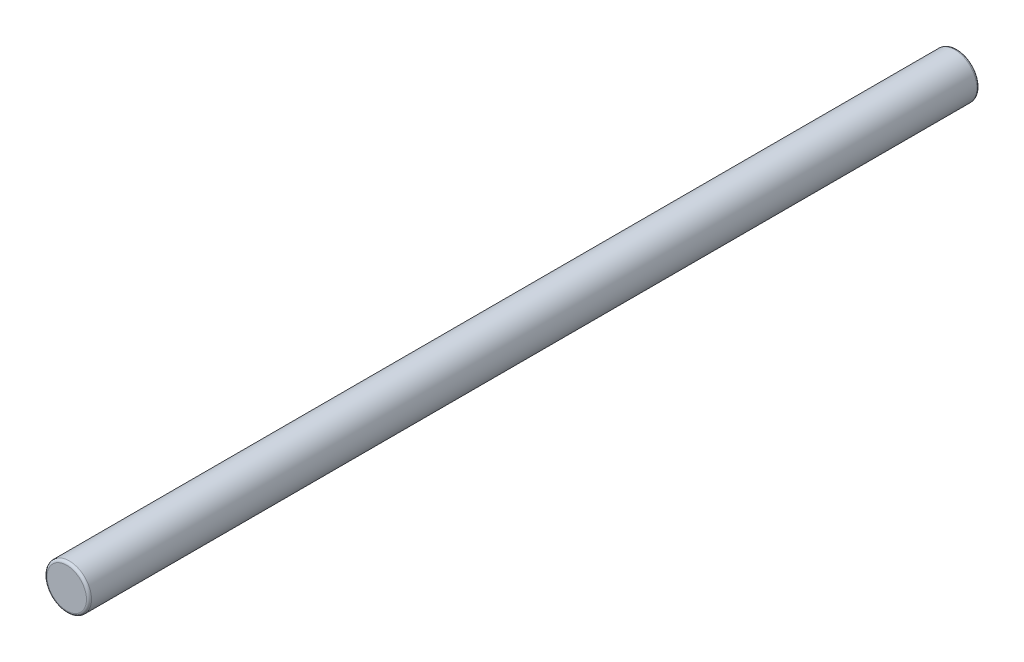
SolidWorks part; units mm, degrees
ref_plane "Piano frontale" through (0, 0, 0) normal (0, 0, 1) x (1, 0, 0)
ref_plane "Piano superiore" through (0, 0, 0) normal (0, 1, 0) x (1, 0, 0)
ref_plane "Piano destro" through (0, 0, 0) normal (1, 0, 0) x (0, 0, -1)
sketch "Schizzo1" plane through (0, 0, 0) normal (0, 0, 1) x (1, 0, 0)
  circle A0 centre (0, 0) radius 17.5
  dimension "D1" = 35
sketch "Schizzo2" plane through (0, 0, 0) normal (1, 0, 0) x (0, 0, -1)
  line L0 (0, 0) -> (700, 0)
  dimension "D1" = 700
sweep "Sweep1" add profiles "Schizzo1" path "Schizzo2"
sketch "Schizzo3" plane through (0, 0, 0) normal (0, 0, 1) x (1, 0, 0)
  circle A0 centre (0, 0) radius 12
  circle A1 centre (0, 0) radius 17.5
  circle A2 centre (0, 0) radius 17.5 construction
  dimension "D1" = 24
extrude "Taglio-Estrusione1" [suppressed] cut sketch "Schizzo3" against normal blind 112.5
sketch "Schizzo4" plane through (0, 0, -700) normal (0, 0, -1) x (-1, 0, 0)
  circle A0 centre (0, 0) radius 12
  circle A1 centre (0, 0) radius 17.5
  circle A2 centre (0, 0) radius 17.5
  dimension "D2" = 24
  dimension "D1" = 0
extrude "Taglio-Estrusione2" [suppressed] cut sketch "Schizzo4" against normal blind 112.5
fillet "Raccordo1" radius 2 2 edges at (17.5, 0, 0) (17.5, 0, -700)
sketch "Linee di piegatura1" [suppressed] plane through (0, 0, 0) normal (0, 1, 0) x (1, 0, 0)
sketch "Casella di contorno1" [suppressed] plane through (0, 0, 0) normal (0, 1, 0) x (1, 0, 0)
equation "\"Lam_vern\"= 2 * ( \"SW-Massa\" / \"SW-Densità\" ) / ( \"Spessore\" / 1000 )"
